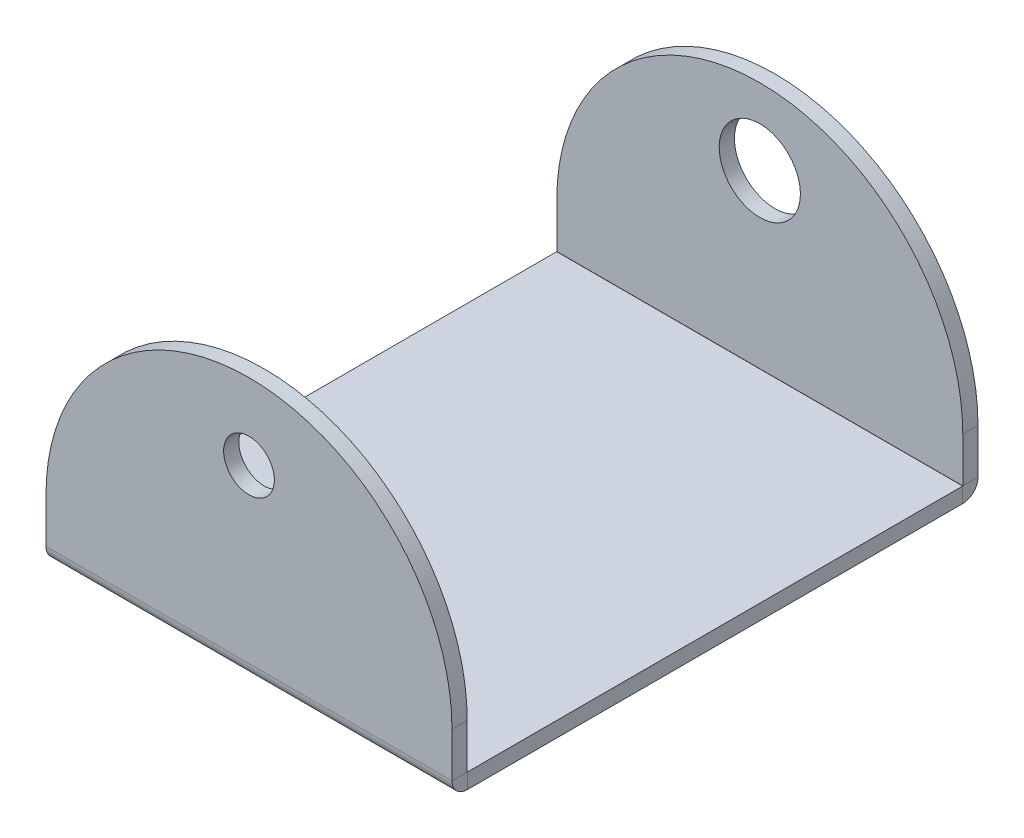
SolidWorks part; units mm, degrees
ref_plane "Front" through (0, 0, 0) normal (0, 0, 1) x (1, 0, 0)
ref_plane "Top" through (0, 0, 0) normal (0, 1, 0) x (1, 0, 0)
ref_plane "Right" through (0, 0, 0) normal (1, 0, 0) x (0, 0, -1)
sketch "Sketch1" plane through (0, 0, 0) normal (0, 1, 0) x (1, 0, 0)
  line L2 (0, 12.5) -> (0, 72.5)
  line L4 (40, 12.5) -> (40, 72.5)
  circle A0 centre (20, 0) radius 2.5
  arc A1 (40, 72.5) -> (0, 72.5) centre (20, 72.5) ccw
  arc A2 (0, 12.5) -> (40, 12.5) centre (20, 12.5) ccw
  circle A3 centre (20, 85) radius 4
sheet metal parameters "Sheet-Metal1" thickness 1.5 parameters "D1"=0.01
base flange "Base-Flange1" sketch "Sketch1" thickness 1.5 reverse thickness direction yes parameters "D1"=0.01
sketch "Sketch3" plane through (0, 1.5, 0) normal (0, 1, 0) x (-1, 0, 0)
  line L3 (0, -17.5) -> (-40, -17.5)
  line L4 (0, -67.5) -> (-40, -67.5)
sketched bend "Sketched Bend1" parameters "D1"=0
bend "SketchBend1" bend radius 0.01 bend angle 90 parameters "D5"=1
bend "SketchBend2" bend radius 0 bend angle 90 parameters "D5"=2
flat pattern "Flat-Pattern1"
sketch "Bend-Lines1" plane through (0, 1.5, 0) normal (0, 1, 0) x (-1, 0, 0)
  line L0 (-40, -67.5) -> (0, -67.5) construction
  line L1 (-40, -17.5) -> (0, -17.5) construction
bend of the flat pattern "Flatten-<SketchBend1>1"
bend of the flat pattern "Flatten-<SketchBend2>1"
